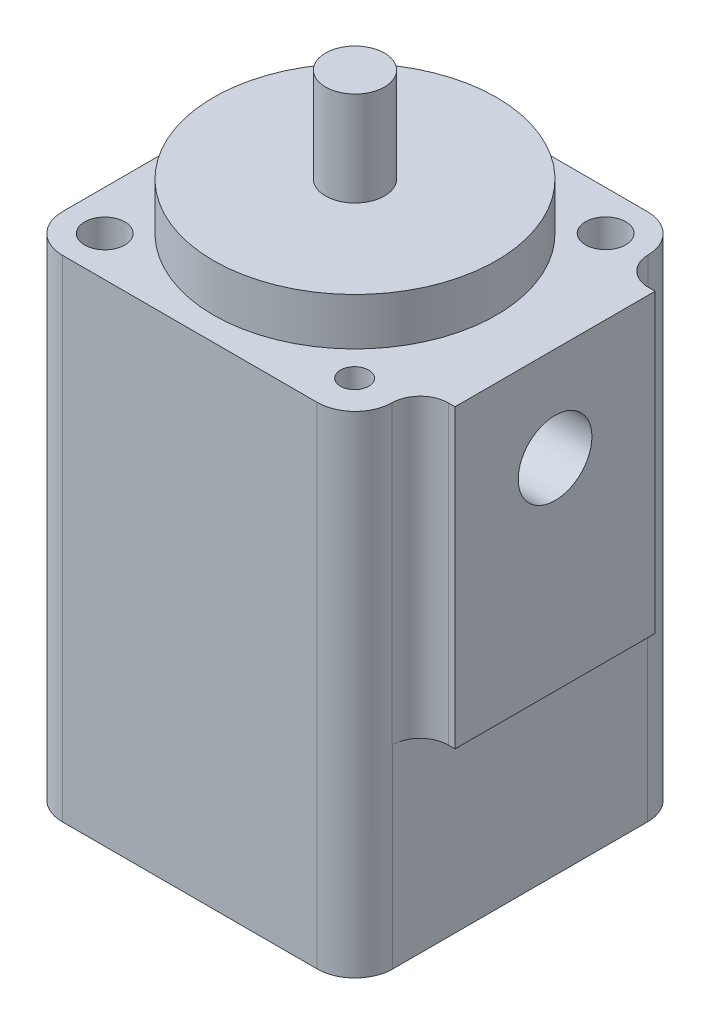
SolidWorks part; units mm, degrees
ref_plane "Front Plane" through (0, 0, 0) normal (0, 0, 1) x (1, 0, 0)
ref_plane "Top Plane" through (0, 0, 0) normal (0, 1, 0) x (1, 0, 0)
ref_plane "Right Plane" through (0, 0, 0) normal (1, 0, 0) x (0, 0, -1)
sketch "Sketch2" plane through (0, 0, 0) normal (0, 1, 0) x (1, 0, 0)
  line L1 (-22.225, -22.225) -> (22.225, -22.225)
  line L2 (-22.225, -22.225) -> (-22.225, 22.225)
  line L3 (-22.225, 22.225) -> (22.225, 22.225)
  line L4 (22.225, -22.225) -> (22.225, 22.225)
  line L5 (-22.225, -22.225) -> (22.225, 22.225) construction
  line L6 (-22.225, 22.225) -> (22.225, -22.225) construction
  point P0 (0, 0)
  dimension "D1" = 44.45
  dimension "D2" = 44.45
extrude "Boss-Extrude1" add sketch "Sketch2" along normal blind 66.04
sketch "Sketch3" plane through (0, 66.04, 0) normal (0, 1, 0) x (1, 0, 0)
  circle A0 centre (0, 0) radius 19.0373
  dimension "D1" = 38.0746
extrude "Boss-Extrude2" add sketch "Sketch3" along normal blind 6.35
sketch "Sketch4" plane through (0, 72.39, 0) normal (0, 1, 0) x (1, 0, 0)
  circle A0 centre (0, 0) radius 3.9688
  dimension "D1" = 7.9375
extrude "Cut-Extrude1" cut sketch "Sketch4" against normal blind 38.1
hole_wizard "7/16-20 Tapped Hole1" positions "Sketch6" profile "Sketch5" tap size "7/16-20" standard "Ansi Inch"
sketch "Sketch6" plane through (0, 0, 0) normal (0, -1, 0) x (1, 0, 0)
  line L0 (0, 22.225) -> (0, -22.225) construction
  line L1 (-22.225, 22.225) -> (22.225, 22.225) construction
  line L2 (22.225, -22.225) -> (-22.225, -22.225) construction
  line L3 (0, 0) -> (-13.2065, 0) construction
  point P0 (0, 9.525)
  point P1 (0, -9.525)
  dimension "D1" = 19.05
  dimension "D2" = 9.525
sketch "Sketch5" plane through (0, 0, 9.525) normal (1, 0, 0) x (0, 0, -1)
  line L0 (0, 0) -> (0, 26.162)
  line L1 (0, 26.162) -> (4.9606, 26.162)
  line L2 (4.9606, 26.162) -> (4.9606, 0)
  line L5 (4.9606, 0) -> (0, 0)
  line L10 (0, 26.162) -> (-4.9606, 26.162) construction
  line L11 (0, -6.35) -> (0, 107.95) construction
  dimension "Tap Drill Dia." = 9.9212
  dimension "Tap Drill Depth" = 26.162
  dimension "Drill Angle" = 180
fillet "Fillet1" radius 5.08 4 edges at (-22.225, 33.02, -22.225) (-22.225, 33.02, 22.225) (22.225, 33.02, -22.225) (22.225, 33.02, 22.225)
sketch "Sketch7" plane through (0, 66.04, 0) normal (0, 1, 0) x (1, 0, 0)
  line L0 (22.225, 0) -> (26.924, 0) construction
  line L1 (22.225, -17.145) -> (22.225, 17.145) construction
  line L2 (22.225, 13.462) -> (26.924, 13.462)
  line L3 (26.924, 13.462) -> (26.924, -13.462)
  line L4 (26.924, -13.462) -> (22.225, -13.462)
  line L5 (0, 0) -> (0, 17.5841) construction
  line L6 (22.225, 13.462) -> (22.225, -13.462)
  dimension "D1" = 26.924
  dimension "D2" = 26.924
extrude "Boss-Extrude3" add sketch "Sketch7" against normal blind 39.878
fillet "Fillet3" radius 3.81 2 edges at (22.225, 46.101, 13.462) (22.225, 46.101, -13.462)
hole_wizard "7/16-20 Tapped Hole2" positions "Sketch9" profile "Sketch8" tap size "7/16-20" standard "Ansi Inch"
sketch "Sketch9" plane through (26.924, 0, 0) normal (1, 0, 0) x (0, 0, -1)
  line L0 (0, 66.04) -> (0, 26.162) construction
  line L1 (-13.462, 66.04) -> (13.462, 66.04) construction
  line L2 (17.145, 26.162) -> (-17.145, 26.162) construction
  point P0 (0, 53.34)
  dimension "D1" = 12.7
sketch "Sketch8" plane through (26.924, 53.34, 0) normal (0, 1, 0) x (0, 0, -1)
  line L0 (0, 0) -> (0, 26.162)
  line L1 (0, 26.162) -> (4.9606, 26.162)
  line L2 (4.9606, 26.162) -> (4.9606, 0)
  line L5 (4.9606, 0) -> (0, 0)
  line L10 (0, 26.162) -> (-4.9606, 26.162) construction
  line L11 (0, -6.35) -> (0, 107.95) construction
  dimension "Tap Drill Dia." = 9.9212
  dimension "Tap Drill Depth" = 26.162
  dimension "Drill Angle" = 180
hole_wizard "#10-24 Tapped Hole1" positions "Sketch11" profile "Sketch10" tap size "#10-24" standard "ANSI Inch"
sketch "Sketch11" plane through (0, 66.04, 0) normal (0, 1, 0) x (-1, 0, 0)
  line L0 (-20.7114, 20.7627) -> (20.7371, -20.7371) construction
  line L1 (0, 0) -> (0, 23.47) construction
  arc A0 (-17.145, 22.225) -> (-22.2245, 17.2176) centre (-17.145, 17.145) ccw construction
  arc A1 (17.145, -22.225) -> (22.225, -17.145) centre (17.145, -17.145) ccw construction
  point P0 (16.8402, -16.8354)
  point P1 (-16.8402, 16.8867)
  dimension "D1" = 16.8402
  dimension "D2" = 16.8402
sketch "Sketch10" plane through (-16.8402, 66.04, -16.8354) normal (1, 0, 0) x (0, 0, 1)
  line L0 (0, 0) -> (0, 66.04)
  line L1 (0, 66.04) -> (1.8986, 66.04)
  line L2 (1.8986, 66.04) -> (1.8986, 0)
  line L5 (1.8986, 0) -> (0, 0)
  line L11 (0, -6.35) -> (0, 107.95) construction
  dimension "Thru Tap Drill Dia." = 3.7973
  dimension "Thru Tap Drill Depth" = 66.04
hole_wizard "#3 (0.213) Diameter Hole1" positions "Sketch13" profile "Sketch14" hole size "#3" standard "Ansi Inch"
sketch "Sketch13" plane through (0, 66.04, 0) normal (0, 1, 0) x (-1, 0, 0)
  line L0 (-20.7114, -20.7627) -> (20.7371, 20.7371) construction
  line L1 (0, 0) -> (0, 17.4002) construction
  arc A0 (-22.2245, -17.2176) -> (-17.145, -22.225) centre (-17.145, -17.145) ccw construction
  arc A1 (22.225, 17.145) -> (17.145, 22.225) centre (17.145, 17.145) ccw construction
  point P0 (-16.8402, -16.8867)
  point P1 (16.8402, 16.8354)
  dimension "D1" = 16.8402
  dimension "D2" = 16.8402
sketch "Sketch14" plane through (16.8402, 66.04, -16.8867) normal (1, 0, 0) x (0, 0, 1)
  line L0 (0, 0) -> (0, 66.04)
  line L1 (0, 66.04) -> (2.7051, 66.04)
  line L2 (2.7051, 66.04) -> (2.7051, 0)
  line L5 (2.7051, 0) -> (0, 0)
  line L11 (0, -6.35) -> (0, 107.95) construction
  dimension "Thru Hole Dia." = 5.4102
  dimension "Thru Hole Depth" = 66.04
sketch "Sketch15" [suppressed] plane through (0, 0, 0) normal (0, -1, 0) x (1, 0, 0)
  arc A0 (4.0506, 0) -> (-4.0506, 0) centre (0, 9.525) ccw
  arc A1 (-4.0506, 0) -> (4.0506, 0) centre (0, -9.525) ccw
  circle A2 centre (0, 9.525) radius 4.9606 construction
  circle A3 centre (0, -9.525) radius 4.9606 construction
  dimension "D1" = 20.701
  dimension "D2" = 20.701
extrude "Cut-Extrude2" [suppressed] cut sketch "Sketch15" against normal blind 0.254
sketch "Sketch21" plane through (41.275, 0, -41.275) normal (0, 1, 0) x (1, 0, 0)
  line L0 (-41.275, -47.625) -> (-41.275, -53.975) construction
  line L1 (-38.1, -50.8) -> (-44.45, -50.8) construction
  line L4 (-41.275, -63.5) -> (-41.275, -19.05) construction
  line L5 (-58.42, -63.5) -> (-24.13, -63.5) construction
  line L6 (-24.13, -19.05) -> (-58.42, -19.05) construction
  line L7 (-41.275, -41.275) -> (-69.2947, -41.275) construction
  circle A0 centre (-41.275, -50.8) radius 3.175
  point P4 (-41.275, -50.8)
  dimension "D1" = 9.525
  dimension "D3" = 6.35
ref_plane "Plane1" through (0, 0, 9.525) normal (0, 0, 1) x (1, 0, 0)
sketch "Port Sketch" plane through (-41.1418, 0, 9.525) normal (0, 0, -1) x (-1, 0, 0)
  line L0 (-41.1418, 0) -> (-41.1418, 45.0293) construction
  line L1 (-41.1418, 17.2346) -> (-36.1811, 14.254)
  line L2 (-36.1811, 14.254) -> (-36.1811, 11.754)
  line L3 (-36.1811, 11.754) -> (-35.5855, 11.754)
  line L4 (-35.5855, 11.754) -> (-35.5855, 2.7644)
  line L5 (-35.5855, 2.7644) -> (-35.6751, 2.854)
  line L6 (-35.6751, 2.854) -> (-35.1652, 0.4552)
  line L7 (-34.9168, 0.254) -> (-30.6418, 0.254)
  line L8 (-30.6418, 0.254) -> (-30.6418, 0)
  line L10 (-30.6418, 0) -> (-41.1418, 0)
  line L11 (-41.1418, 0) -> (-41.1418, 17.2346)
  line L12 (-46.6084, 2.854) -> (-47.1183, 0.4552) construction
  line L13 (-46.698, 2.7644) -> (-46.6084, 2.854) construction
  line L14 (-41.1418, 17.2346) -> (-46.1024, 14.254) construction
  arc A0 (-35.1652, 0.4552) -> (-34.9168, 0.254) centre (-34.9168, 0.508) ccw
  dimension "D1" = 0.254
  dimension "Countersink angle" = 118
  dimension "D3" = 45
  dimension "TapDrillDia" = 9.9212
  dimension "D5" = 12.45
  dimension "ThdMjr" = 11.1125
  dimension "SpotDia" = 21
  dimension "L3" = 0.254
  dimension "L1" = 2.6
  dimension "ThdDp" = 11.5
  dimension "TapDrillDp" = 14
  dimension "K" = 12
revolve "SAE Port" cut sketch "Port Sketch" angle 360 about L0
other "sae j1926-1 (rectangular face)<1>"
pattern_linear "LPattern1" count 2 spacing 19.05 along (0, 0, -1) of "SAE Port"
sketch "Sketch22" plane through (0, 0, 0) normal (0, 0, 1) x (1, 0, 0)
sketch "Sketch23" plane through (0, 0, 0) normal (0, 0, 1) x (1, 0, 0)
  line L0 (0, 0) -> (0, 75.9121) construction
  line L1 (-17.145, 0) -> (17.145, 0) construction
  line L2 (19.0373, 72.39) -> (-19.0373, 72.39) construction
  line L3 (0, 46.99) -> (-3.9624, 46.99)
  line L4 (0, 46.99) -> (0, 85.09)
  line L5 (0, 85.09) -> (-3.9624, 85.09)
  line L6 (-3.9624, 46.99) -> (-3.9624, 85.09)
  dimension "D1" = 7.9248
  dimension "D2" = 12.7
  dimension "D3" = 25.4
revolve "Revolve1" add sketch "Sketch23" angle 360 about L0
